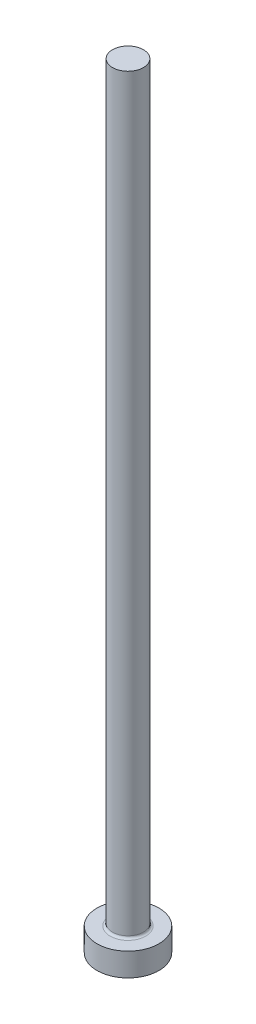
SolidWorks part; units mm, degrees
ref_plane "Plano frontal" through (0, 0, 0) normal (0, 0, 1) x (1, 0, 0)
ref_plane "Plano superior" through (0, 0, 0) normal (0, 1, 0) x (1, 0, 0)
ref_plane "Plano direito" through (0, 0, 0) normal (1, 0, 0) x (0, 0, -1)
sketch "Esboço1" plane through (0, 0, 0) normal (0, 0, 1) x (1, 0, 0)
  line L0 (0, 0) -> (4, 0)
  line L1 (4, 0) -> (4, 3)
  line L2 (4, 3) -> (2.3, 3)
  line L3 (2, 3.3) -> (2, 100)
  line L4 (2, 100) -> (0, 100)
  line L5 (0, 100) -> (0, 0) construction
  line L6 (0, 0) -> (0, 100)
  arc A0 (2.3, 3) -> (2, 3.3) centre (2.3, 3.3) cw
  dimension "D3" = 0.3
  dimension "D1" = 8
  dimension "D2" = 4
  dimension "D4" = 3
  dimension "D5" = 100
revolve "Revolução1" add sketch "Esboço1" angle 360 about L5
sketch "Esboço2"
  dimension "D1" = 0.45
  dimension "D2" = 0.7
  dimension "D3" = 0.3
  dimension "D4" = 2.15
wrap "Envolver1" sketch "Esboço2" wrap type deboss source sketch "Esboço2" thickness 0.1 parameters "D1"=0.1
